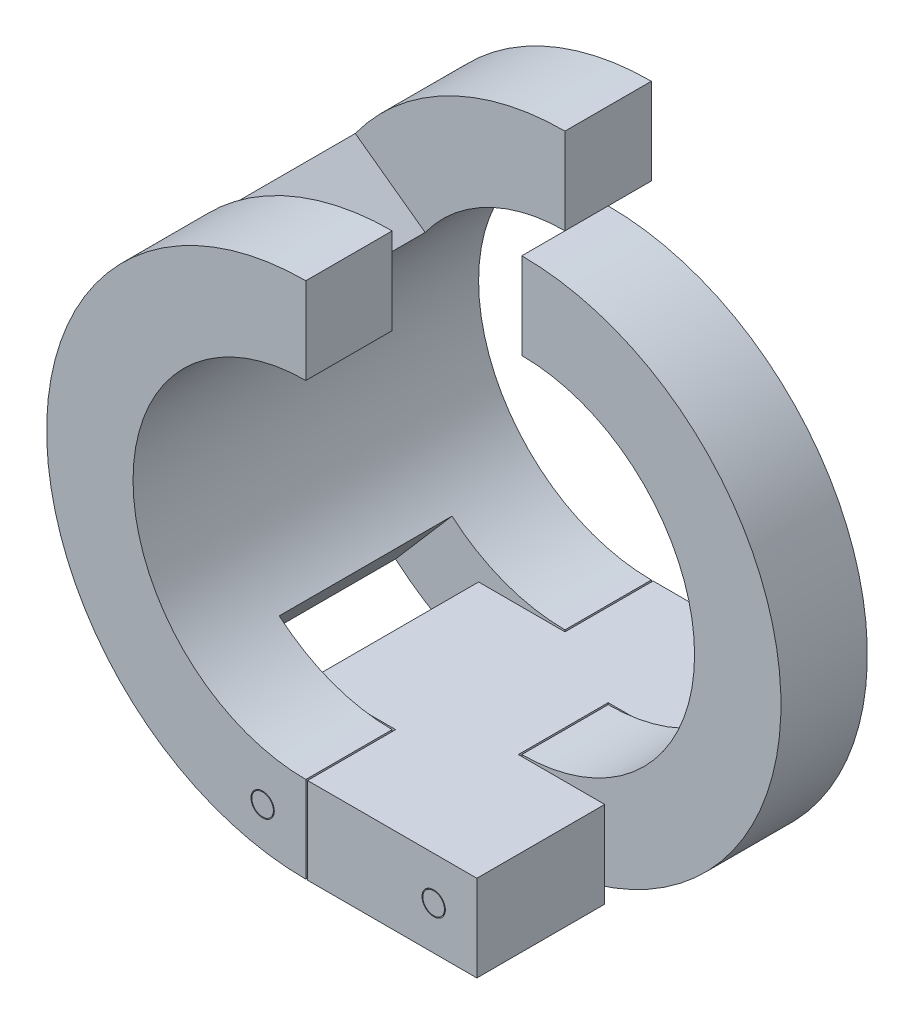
SolidWorks part; units mm, degrees
ref_plane "Front Plane" through (0, 0, 0) normal (0, 0, 1) x (1, 0, 0)
ref_plane "Top Plane" through (0, 0, 0) normal (0, 1, 0) x (1, 0, 0)
ref_plane "Right Plane" through (0, 0, 0) normal (1, 0, 0) x (0, 0, -1)
sketch "Sketch1" plane through (0, 0, 0) normal (0, 0, 1) x (1, 0, 0)
  line L0 (0, 19.05) -> (0, 12.7)
  line L1 (0, -19.05) -> (0, -12.7)
  circle A0 centre (0, 0) radius 6.35
  circle A1 centre (0, 0) radius 19.05
  arc A2 (0, 12.7) -> (0, -12.7) centre (0, 0) ccw
  arc A3 (0, -19.05) -> (0, 19.05) centre (0, 0) cw
  dimension "D1" = 12.7
  dimension "D2" = 38.1
  dimension "D3" = 6.35
  dimension "D4" = 6.35
extrude "Boss-Extrude1" add sketch "Sketch1" along normal blind 6.35 contours A3 L0 A2 L1
ref_plane "Plane1" through (0, 0, 19.05) normal (0, 0, 1) x (1, 0, 0)
sketch "Sketch3" plane through (0, 0, 19.05) normal (0, 0, 1) x (1, 0, 0)
  line L0 (0, -19.05) -> (0, -12.7) construction
  line L1 (0, 19.05) -> (0, 12.7) construction
  line L2 (0, -19.05) -> (0, -12.7)
  line L3 (0, 19.05) -> (0, 12.7)
  arc A0 (0, 12.7) -> (0, -12.7) centre (0, 0) ccw construction
  arc A1 (0, 19.05) -> (0, -19.05) centre (0, 0) ccw construction
  arc A2 (0, 12.7) -> (0, -12.7) centre (0, 0) ccw
  arc A3 (0, 19.05) -> (0, -19.05) centre (0, 0) ccw
extrude "Boss-Extrude2" add sketch "Sketch3" along normal blind 6.35 separate body contours L2 A2 L3 A3
ref_plane "Plane2" through (0, 0, 12.7) normal (0, 0, 1) x (1, 0, 0)
sketch "Sketch4" plane through (0, 0, 12.7) normal (0, 0, 1) x (1, 0, 0)
  line L0 (6.35, 19.05) -> (6.35, 12.7)
  line L1 (0, 19.05) -> (0, 12.7) construction
  line L2 (6.35, -12.7) -> (6.35, -19.05)
  arc A0 (6.35, -12.7) -> (6.35, 12.7) centre (6.35, 0) ccw
  arc A1 (6.35, 19.05) -> (6.35, -19.05) centre (6.35, 0) cw
  dimension "D1" = 6.35
  dimension "D2" = 6.35
  dimension "D3" = 6.35
extrude "Boss-Extrude3" add sketch "Sketch4" along normal blind 3.175 and the other way blind 3.175 separate body contours A1 L2 A0 L0
sketch "Sketch5" plane through (0, 0, 6.35) normal (0, 0, 1) x (1, 0, 0)
  line L0 (-10.2768, 7.4618) -> (-15.4151, 11.1927)
  line L1 (-8.3032, -9.6097) -> (-12.4548, -14.4146)
  arc A0 (0, 12.7) -> (0, -12.7) centre (0, 0) ccw construction
  arc A1 (0, 19.05) -> (0, -19.05) centre (0, 0) ccw construction
  arc A2 (-10.2768, 7.4618) -> (-8.3032, -9.6097) centre (0, 0) ccw
  arc A3 (-15.4151, 11.1927) -> (-12.4548, -14.4146) centre (0, 0) ccw
extrude "Boss-Extrude4" add sketch "Sketch5" along normal up to surface (12.7 mm away) contours A3 L1 A2 L0
ref_plane "Plane3" through (0, -19.05, 0) normal (0, 1, 0) x (0, 0, -1)
sketch "Sketch6" plane through (0, -19.05, 0) normal (0, 1, 0) x (0, 0, -1)
  line L0 (-25.4, -0.127) -> (-18.923, -0.127)
  line L3 (-18.923, -0.127) -> (-18.923, 6.223)
  line L4 (-18.923, 6.223) -> (-6.477, 6.223)
  line L5 (-6.477, 6.223) -> (-6.477, -0.127)
  line L6 (-6.477, -0.127) -> (0, -0.127)
  line L7 (0, -0.127) -> (0, -12.573)
  line L8 (0, -12.573) -> (-9.398, -12.573)
  line L9 (-9.525, -6.35) -> (-15.875, -6.35) construction
  line L10 (-9.398, -12.573) -> (-9.398, -6.223)
  line L11 (-9.398, -6.223) -> (-16.002, -6.223)
  line L12 (-16.002, -6.223) -> (-16.002, -12.573)
  line L13 (-9.525, -6.35) -> (-15.875, -6.35)
  line L14 (-16.002, -12.573) -> (-25.4, -12.573)
  line L15 (-25.4, -12.573) -> (-25.4, -0.127)
  line L16 (-25.4, 0) -> (-19.05, 0) construction
  line L17 (-6.35, 0) -> (0, 0) construction
  line L18 (-6.35, 12.4548) -> (-6.35, 0) construction
  line L19 (-19.05, 5.1922) -> (-19.05, -5.1922) construction
  dimension "D1" = 6.35
  dimension "D2" = 0.127
  dimension "D3" = 9.398
  dimension "D4" = 9.398
  dimension "D5" = 0.127
  dimension "D6" = 0.127
  dimension "D7" = 0.127
  dimension "D8" = 0.127
  dimension "D9" = 6.35
  dimension "D10" = 25.4
  dimension "D11" = 2.921
extrude "Boss-Extrude5" add sketch "Sketch6" along normal blind 6.35 separate body contours L15 L14 L12 L11 L10 L8 L7 L6 L5 L4 L3 L0
sketch "Sketch7" plane through (0, 0, 25.4) normal (0, 0, 1) x (1, 0, 0)
  line L0 (12.573, -12.7) -> (12.573, -19.05) construction
  line L1 (12.573, -12.7) -> (0.127, -12.7) construction
  line L2 (6.223, -12.7) -> (6.223, -19.05) construction
  line L3 (12.573, -19.05) -> (0.127, -19.05) construction
  line L5 (0, -19.05) -> (0, -12.7) construction
  circle A0 centre (9.398, -15.875) radius 0.8572
  circle A1 centre (-3.175, -15.875) radius 0.8572
  dimension "D5" = 1.7145
  dimension "D2" = 3.175
  dimension "D3" = 3.175
  dimension "D4" = 6.35
  dimension "D6" = 3.175
  dimension "D7" = 3.175
extrude "Cut-Extrude1" cut sketch "Sketch7" against normal through all both and the other way through all contours A0 | A1
sketch "Sketch8" plane through (0, 0, 25.4) normal (0, 0, 1) x (1, 0, 0)
  circle A0 centre (-3.175, -15.875) radius 0.7938
  circle A1 centre (9.398, -15.875) radius 0.7937
  dimension "D1" = 1.5875
  dimension "D2" = 1.5875
extrude "Boss-Extrude6" add sketch "Sketch8" against normal through all contours A0 | A1
